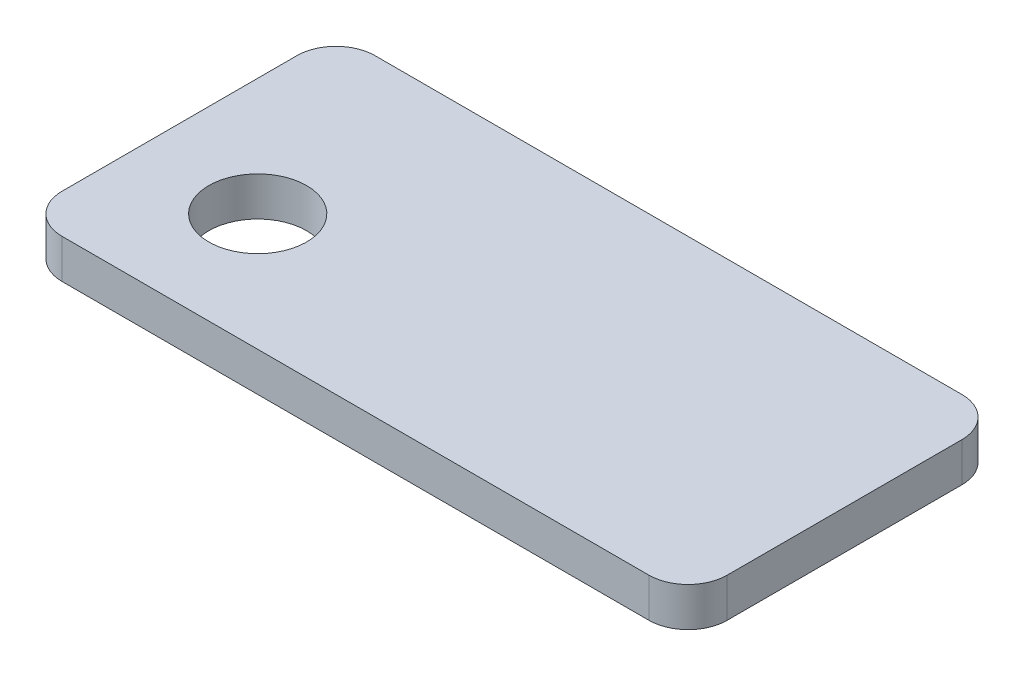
SolidWorks part; units mm, degrees
ref_plane "Plan de face" through (0, 0, 0) normal (0, 0, 1) x (1, 0, 0)
ref_plane "Plan de dessus" through (0, 0, 0) normal (0, 1, 0) x (1, 0, 0)
ref_plane "Plan de droite" through (0, 0, 0) normal (1, 0, 0) x (0, 0, -1)
ref_plane "Plan1" through (0, 2.5, 0) normal (0, 1, 0) x (1, 0, 0)
sketch "Esquisse1" plane through (0, 2.5, 0) normal (0, 1, 0) x (1, 0, 0)
  line L0 (-37.5, -20) -> (37.5, -20)
  line L1 (42.5, -15) -> (42.5, 15)
  line L2 (37.5, 20) -> (-37.5, 20)
  line L3 (-42.5, 15) -> (-42.5, -15)
  circle A0 centre (-27.5, -5) radius 6.25
  arc A1 (-42.5, -15) -> (-37.5, -20) centre (-37.5, -15) ccw
  arc A2 (37.5, -20) -> (42.5, -15) centre (37.5, -15) ccw
  arc A3 (42.5, 15) -> (37.5, 20) centre (37.5, 15) ccw
  arc A4 (-37.5, 20) -> (-42.5, 15) centre (-37.5, 15) ccw
extrude "Boss.-Extru.1" add sketch "Esquisse1" against normal blind 5
